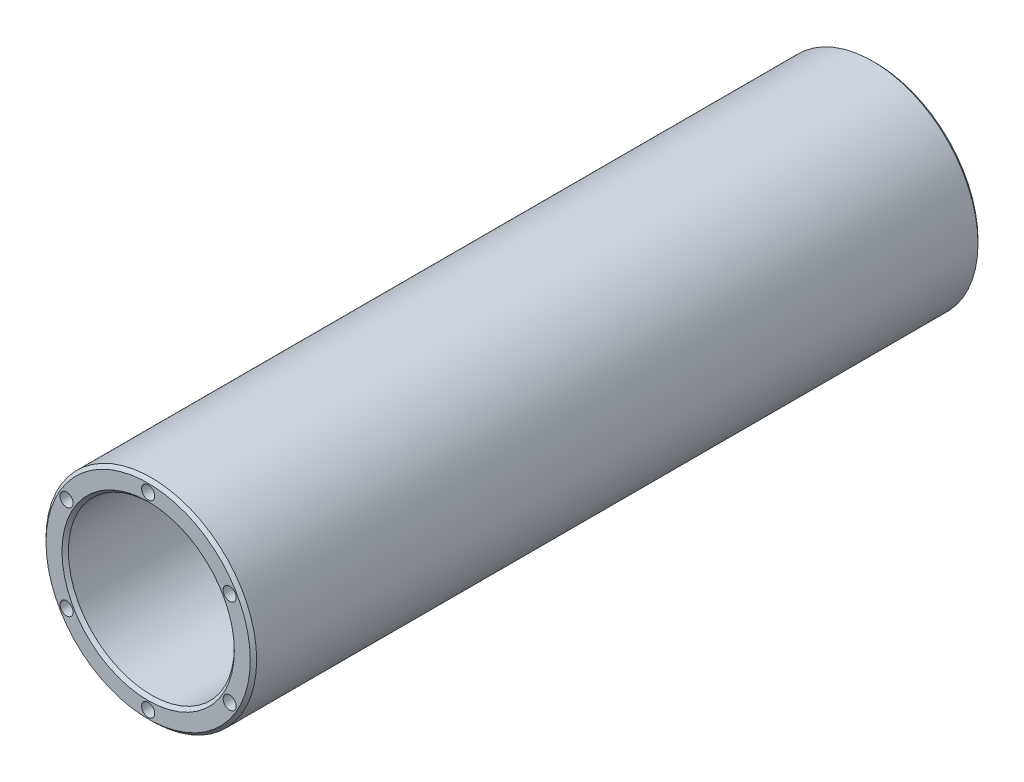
SolidWorks part; units mm, degrees
ref_plane "前视基准面" through (0, 0, 0) normal (0, 0, 1) x (1, 0, 0)
ref_plane "上视基准面" through (0, 0, 0) normal (0, 1, 0) x (1, 0, 0)
ref_plane "右视基准面" through (0, 0, 0) normal (1, 0, 0) x (0, 0, -1)
other "Configuration Table"
sketch "草图1" plane through (0, 0, 0) normal (0, 0, 1) x (1, 0, 0)
  circle A0 centre (0, 0) radius 16.5
  circle A1 centre (0, 0) radius 13
  dimension "D1" = 33
  dimension "D2" = 3.5
extrude "凸台-拉伸1" add sketch "草图1" along normal mid plane 114
sketch "草图2" plane through (0, 0, -57) normal (0, 0, -1) x (-1, 0, 0)
  line L0 (0, 0) -> (0, 14.75) construction
  circle A0 centre (0, 0) radius 14.75 construction
  dimension "D1" = 29.5
hole_wizard "M2.5 螺纹孔1" positions "3D草图1" profile "草图3" tap size "M2.5" standard "GB"
sketch3d "3D草图1"
  point P0 (0, 14.75, -57)
sketch "草图3" plane through (0, 14.75, -57) normal (1, 0, 0) x (0, 1, 0)
  line L0 (0, 0) -> (0, 12.6159)
  line L1 (0, 12.6159) -> (1.025, 12)
  line L2 (1.025, 12) -> (1.025, 0)
  line L5 (1.025, 0) -> (0, 0)
  line L10 (0, 12.6159) -> (-1.025, 12) construction
  line L11 (0, -6.35) -> (0, 107.95) construction
  dimension "螺纹孔钻头直径" = 2.05
  dimension "螺纹孔钻头深度" = 12
  dimension "导头角度" = 118
pattern_circular "阵列(圆周)1" count 6 over 360 about axis through (0, 0, 0) along (0, 0, 1) of "M2.5 螺纹孔1"
mirror "镜向1" about plane through (0, 0, 0) normal (0, 0, 1) of "阵列(圆周)1", "M2.5 螺纹孔1"
chamfer "倒角1" distance 0.5 angle 45 4 edges at (16.5, 0, -57) (16.5, 0, 57) (13, 0, -57) (13, 0, 57)
